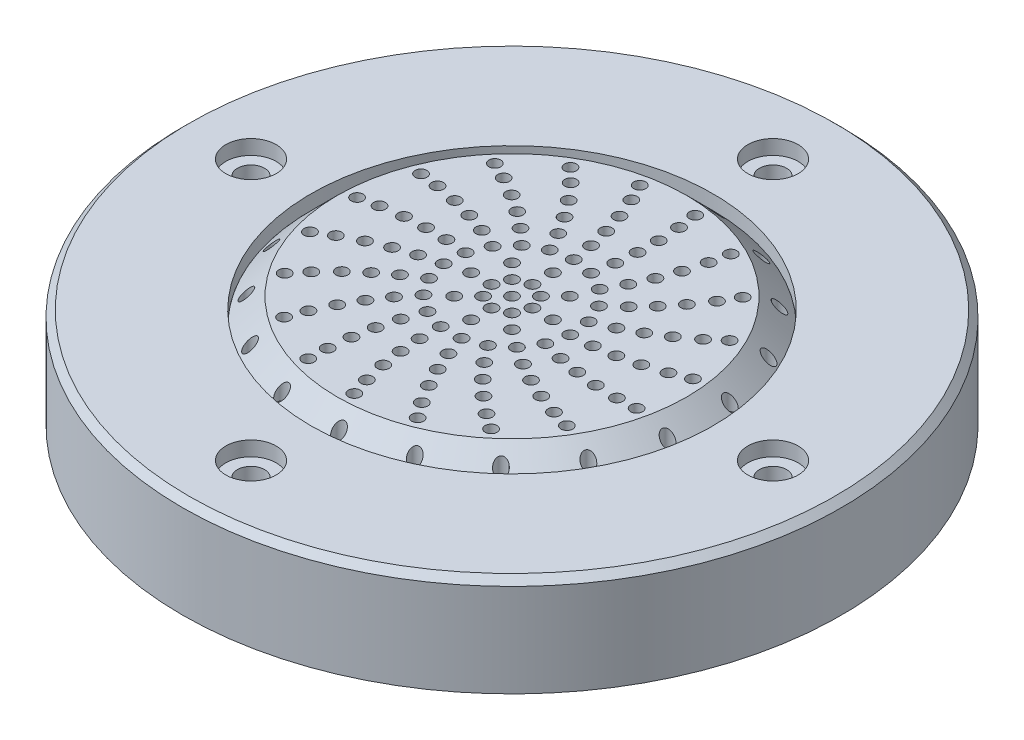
SolidWorks part; units mm, degrees
ref_plane "Front Plane" through (0, 0, 0) normal (0, 0, 1) x (1, 0, 0)
ref_plane "Top Plane" through (0, 0, 0) normal (0, 1, 0) x (1, 0, 0)
ref_plane "Right Plane" through (0, 0, 0) normal (1, 0, 0) x (0, 0, -1)
sketch "Sketch1" plane through (0, 0, 0) normal (0, 0, 1) x (1, 0, 0)
  line L0 (0, 0) -> (-31.115, 0)
  line L1 (-31.75, -0.635) -> (-31.75, -9.6012)
  line L2 (-31.75, -9.6012) -> (-30.3403, -9.6012)
  line L3 (-30.3403, -9.6012) -> (-30.3403, -1.4097)
  line L4 (-30.3403, -1.4097) -> (0, -1.4097)
  line L5 (0, -1.4097) -> (0, 0)
  line L6 (0, -1.4097) -> (0, -24.1874) construction
  line L7 (-31.115, 0) -> (-31.75, -0.635)
  point P1 (-31.75, 0)
  dimension "D1" = 63.5
  dimension "D2" = 9.6012
  dimension "D3" = 1.4097
  dimension "D4" = 1.4097
revolve "Revolve1" add sketch "Sketch1" angle 360 about L6
sketch "Sketch2" plane through (0, 0, 0) normal (0, 1, 0) x (1, 0, 0)
  circle A0 centre (0, 0) radius 19.3675
  circle A1 centre (0, 0) radius 25.146 construction
  circle A2 centre (-25.146, 0) radius 2.4257
  circle A3 centre (0, 25.146) radius 2.4257
  circle A4 centre (25.146, 0) radius 2.4257
  circle A5 centre (0, -25.146) radius 2.4257
  dimension "D1" = 38.735
  dimension "D2" = 50.292
  dimension "D3" = 4.8514
extrude "Cut-Extrude1" cut sketch "Sketch2" against normal through all
sketch "Sketch3" plane through (0, -1.4097, 0) normal (0, -1, 0) x (1, 0, 0)
  circle A0 centre (0, 0) radius 19.3675 construction
  circle A1 centre (0, 0) radius 19.3675
extrude "Boss-Extrude1" add sketch "Sketch3" against normal blind 2.54 draft 45 separate body
sketch "Sketch4" plane through (0, 1.1303, 0) normal (0, 1, 0) x (1, 0, 0)
  line L0 (0, 0) -> (-18.2361, 0) construction
  circle A0 centre (-5.8701, 1.3988) radius 0.5726
  arc A1 (-18.2361, 0) -> (0, 0) centre (-9.118, -25.2478) cw construction
  circle A2 centre (0, 0) radius 0.5726
  circle A3 centre (-15.6992, 0.7768) radius 0.5726
  circle A4 centre (-13.9256, 1.162) radius 0.5726
  circle A5 centre (-9.8683, 1.5855) radius 0.5726
  circle A6 centre (-11.8628, 1.4553) radius 0.5726
  circle A7 centre (0, 0) radius 18.2361 construction
  circle A8 centre (-7.8882, 1.5678) radius 0.5726
  circle A9 centre (-18.2361, 0) radius 0.5726
  dimension "D1" = 36.4721
extrude "Cut-Extrude2" cut sketch "Sketch4" against normal through all
pattern_circular "CirPattern4" count 19 over 360 about axis through (0, 0, 0) along (0, 1, 0) of "Cut-Extrude2"
sketch "Sketch5" plane through (0, 1.1303, 0) normal (0, 1, 0) x (1, 0, 0)
  line L0 (0, 0) -> (-3.9404, 0) construction
  circle A0 centre (-3.9404, 0) radius 0.5726
  circle A1 centre (-1.9702, 0) radius 0.5726
  circle A2 centre (0, 0) radius 0.5726 construction
extrude "Cut-Extrude3" cut sketch "Sketch5" against normal through all
pattern_circular "CirPattern8" count 8 over 360 about axis through (0, 0, 0) along (0, 1, 0) of "Cut-Extrude3"
sketch "Sketch6" plane through (0, -1.4097, 0) normal (0, -1, 0) x (1, 0, 0)
  circle A0 centre (0, 25.146) radius 3.8756
  circle A1 centre (25.146, 0) radius 3.8756
  circle A2 centre (0, -25.146) radius 3.8756
  circle A3 centre (-25.146, 0) radius 3.8756
  circle A4 centre (-25.146, 0) radius 1.305
  circle A5 centre (0, 25.146) radius 1.305
  circle A6 centre (25.146, 0) radius 1.305
  circle A7 centre (0, -25.146) radius 1.305
extrude "Boss-Extrude2" add sketch "Sketch6" along normal blind 2.54
